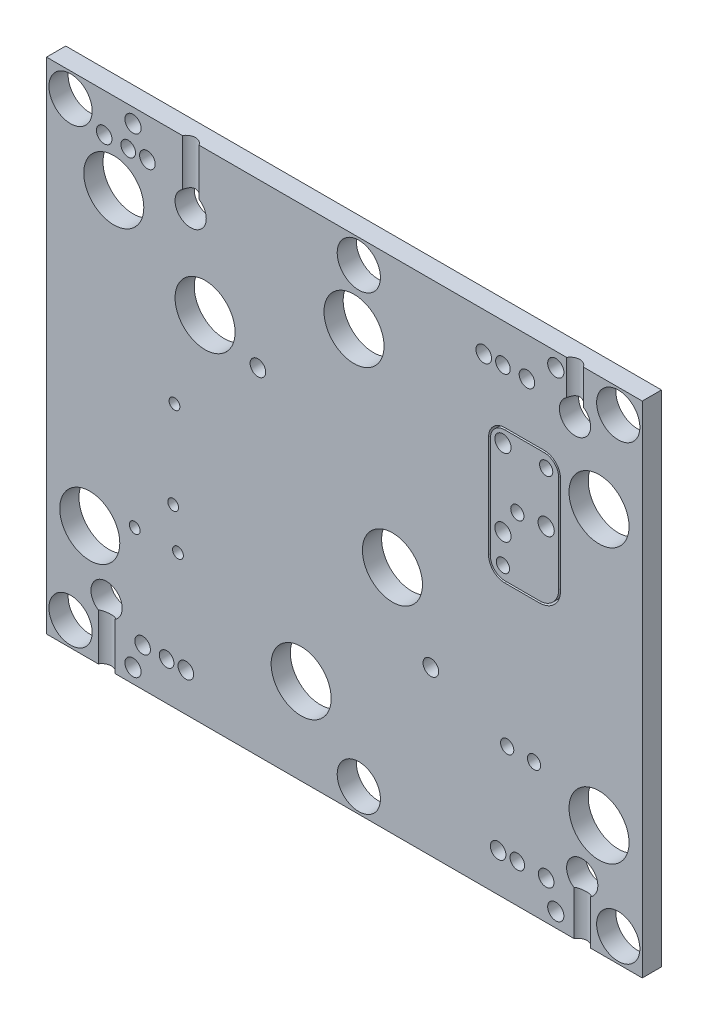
SolidWorks part; units mm, degrees
other "<24051_310_Perf Back-up>-<Hole1>"
ref_plane "Front" through (0, 0, 0) normal (0, 0, 1) x (1, 0, 0)
ref_plane "Top" through (0, 0, 0) normal (0, 1, 0) x (1, 0, 0)
ref_plane "Right" through (0, 0, 0) normal (1, 0, 0) x (0, 0, -1)
sketch "Sketch1" plane through (0, 0, 0) normal (0, 0, 1) x (1, 0, 0)
  line L4 (-57.15, 149.225) -> (-450.85, 149.225)
  line L5 (-450.85, 149.225) -> (-450.85, -180.975)
  line L6 (-450.85, -180.975) -> (-57.15, -180.975)
  line L7 (-57.15, -180.975) -> (-57.15, 149.225)
  line L8 (-57.15, 149.225) -> (-450.85, 149.225)
  line L9 (-450.85, 149.225) -> (-450.85, -180.975)
  line L10 (-450.85, -180.975) -> (-57.15, -180.975)
  line L11 (-57.15, -180.975) -> (-57.15, 149.225)
  dimension "D1" = 0
extrude "Boss-Extrude1" add sketch "Sketch1" along normal blind 12.7 separate body
hole_wizard "Hole1" positions "Point_Sketch" profile "Profil_Sketch" hole size "Ø0.15" standard "ISO"
sketch "Point_Sketch" plane through (-122.7107, 32.8261, 0) normal (0, 0, 1) x (-1, 0, 0)
  point P0 (7.4643, 18.8561)
  point P2 (11.2743, -43.0691)
  point P5 (11.2743, -43.0691)
sketch "Profil_Sketch" plane through (-130.175, 13.97, 0) normal (1, 0, 0) x (0, 1, 0)
  line L0 (0, 0) -> (0, 12.7)
  line L1 (0, 12.7) -> (0.0005, 12.7)
  line L2 (0.0005, 12.7) -> (0.0005, 0)
  line L5 (0.0005, 0) -> (0, 0)
  line L11 (0, -6.35) -> (0, 107.95) construction
  dimension "Diameter" = 0.001
  dimension "Thru Hole Depth" = 12.7
other "usin_Temp_Suppressed<1>"
sketch "Sketch6-P250520R_310_Perf Back-up-1" plane through (0, 0, 0) normal (0, 0, -1) x (-1, 0, 0)
  line L0 (147.955, 87.3252) -> (121.92, 87.3252)
  line L1 (112.395, 77.8002) -> (112.395, 13.6652)
  line L2 (125.095, 0.9652) -> (147.955, 0.9652)
  line L3 (157.48, 10.4902) -> (157.48, 77.8002)
  line L4 (157.48, 10.4902) -> (157.48, 77.8002)
  line L5 (125.095, 0.9652) -> (147.955, 0.9652)
  line L6 (112.395, 77.8002) -> (112.395, 13.6652)
  line L7 (147.955, 87.3252) -> (121.92, 87.3252)
  arc A0 (121.92, 87.3252) -> (112.395, 77.8002) centre (121.92, 77.8002) ccw
  arc A1 (112.395, 13.6652) -> (125.095, 0.9652) centre (125.095, 13.6652) ccw
  arc A2 (147.955, 0.9652) -> (157.48, 10.4902) centre (147.955, 10.4902) ccw
  arc A3 (157.48, 77.8002) -> (147.955, 87.3252) centre (147.955, 77.8002) ccw
  arc A4 (157.48, 77.8002) -> (147.955, 87.3252) centre (147.955, 77.8002) ccw
  arc A5 (147.955, 0.9652) -> (157.48, 10.4902) centre (147.955, 10.4902) ccw
  arc A6 (112.395, 13.6652) -> (125.095, 0.9652) centre (125.095, 13.6652) ccw
  arc A7 (121.92, 87.3252) -> (112.395, 77.8002) centre (121.92, 77.8002) ccw
  circle A9 centre (149.225, 28.2702) radius 3.5687
  arc A10 (128.1938, 79.0702) -> (128.1938, 79.0702) centre (123.825, 79.0702) ccw
  circle A11 centre (142.875, 44.1452) radius 4.3688
  circle A12 centre (149.225, 9.2202) radius 4.3688
  circle A15 centre (120.65, 45.7327) radius 3.5687
  circle A16 centre (149.225, 28.2702) radius 3.5687
  circle A21 centre (120.65, 45.7327) radius 3.5687
  circle A24 centre (149.225, 28.2702) radius 3.5687
sketch "Sketch7-P250520R_310_Perf Back-up-1" plane through (0, 0, 0) normal (0, 0, -1) x (-1, 0, 0)
  line L4 (147.955, 88.5952) -> (121.92, 88.5952)
  line L5 (111.125, 77.8002) -> (111.125, 13.6652)
  line L6 (125.095, -0.3048) -> (147.955, -0.3048)
  line L7 (158.75, 10.4902) -> (158.75, 77.8002)
  line L8 (147.955, 88.5952) -> (121.92, 88.5952)
  line L9 (111.125, 77.8002) -> (111.125, 13.6652)
  line L10 (125.095, -0.3048) -> (147.955, -0.3048)
  line L11 (158.75, 10.4902) -> (158.75, 77.8002)
  arc A4 (121.92, 88.5952) -> (111.125, 77.8002) centre (121.92, 77.8002) ccw
  arc A5 (111.125, 13.6652) -> (125.095, -0.3048) centre (125.095, 13.6652) ccw
  arc A6 (147.955, -0.3048) -> (158.75, 10.4902) centre (147.955, 10.4902) ccw
  arc A7 (158.75, 77.8002) -> (147.955, 88.5952) centre (147.955, 77.8002) ccw
  arc A8 (121.92, 88.5952) -> (111.125, 77.8002) centre (121.92, 77.8002) ccw
  arc A9 (111.125, 13.6652) -> (125.095, -0.3048) centre (125.095, 13.6652) ccw
  arc A10 (147.955, -0.3048) -> (158.75, 10.4902) centre (147.955, 10.4902) ccw
  arc A11 (158.75, 77.8002) -> (147.955, 88.5952) centre (147.955, 77.8002) ccw
extrude "Cut-Extrude9" cut sketch "Sketch7-P250520R_310_Perf Back-up-1" against normal through all
hole_wizard "Hole14" positions "Point_Sketch4" profile "Profil_Sketch4" hole size "Ø0.15" standard "ISO"
sketch "Point_Sketch4" plane through (-43.9707, -113.2239, 0) normal (0, 0, 1) x (-1, 0, 0)
  point P0 (95.7293, 42.3511)
  point P2 (352.9043, -237.0489)
  point P4 (327.5043, 42.3511)
  point P6 (105.2543, -237.0489)
sketch "Profil_Sketch4" plane through (-139.7, -155.575, 0) normal (1, 0, 0) x (0, 1, 0)
  line L0 (0, 0) -> (0, 12.7)
  line L1 (0, 12.7) -> (4.826, 12.7)
  line L2 (4.826, 12.7) -> (4.826, 0)
  line L5 (4.826, 0) -> (0, 0)
  line L11 (0, -6.35) -> (0, 107.95) construction
  dimension "Diameter" = 9.652
  dimension "Thru Hole Depth" = 12.7
other "usin_DL090_.375 x 2.00 DOWEL PIN<4>"
hole_wizard "Hole15" positions "Point_Sketch5" profile "Profil_Sketch5" hole size "Ø0.15" standard "ISO"
sketch "Point_Sketch5" plane through (-364.6457, -113.2239, 0) normal (0, 0, 1) x (-1, 0, 0)
  point P0 (22.7043, 42.3511)
  point P2 (48.1043, -237.0489)
  point P4 (-231.2957, -237.0489)
  point P6 (-243.9957, 42.3511)
  point P8 (-53.4957, -154.4989)
  point P10 (-167.7957, -40.1989)
sketch "Profil_Sketch5" plane through (-387.35, -155.575, 0) normal (1, 0, 0) x (0, 1, 0)
  line L0 (0, 0) -> (0, 12.7)
  line L1 (0, 12.7) -> (5.1562, 12.7)
  line L2 (5.1562, 12.7) -> (5.1562, 0)
  line L5 (5.1562, 0) -> (0, 0)
  line L11 (0, -6.35) -> (0, 107.95) construction
  dimension "Diameter" = 10.3124
  dimension "Thru Hole Depth" = 12.7
other "usin_DL090_.375-16x2-SHCS<5>"
hole_wizard "Hole16" positions "Point_Sketch6" profile "Profil_Sketch6" hole size "Ø0.15" standard "ISO"
sketch "Point_Sketch6" plane through (-78.8957, -110.0489, 0) normal (0, 0, 1) x (-1, 0, 0)
  point P0 (-5.8707, 55.0511)
  point P2 (-5.8707, -243.3989)
  point P4 (356.0793, -243.3989)
  point P6 (356.0793, 55.0511)
  point P8 (165.5793, 55.0511)
  point P10 (165.5793, -243.3989)
sketch "Profil_Sketch6" plane through (-73.025, -165.1, 0) normal (1, 0, 0) x (0, 1, 0)
  line L0 (0, 0) -> (0, 12.7)
  line L1 (0, 12.7) -> (14.2875, 12.7)
  line L2 (14.2875, 12.7) -> (14.2875, 0)
  line L5 (14.2875, 0) -> (0, 0)
  line L11 (0, -6.35) -> (0, 107.95) construction
  dimension "Diameter" = 28.575
  dimension "Thru Hole Depth" = 12.7
other "usin_DL090<6>"
hole_wizard "Hole17" positions "Point_Sketch7" profile "Profil_Sketch7" hole size "Ø0.15" standard "ISO"
sketch "Point_Sketch7" plane through (-51.2793, -68.7739, 12.7) normal (0, 0, -1) x (1, 0, 0)
  point P0 (-34.4457, 39.1761)
  point P2 (-34.4457, -141.7989)
  point P4 (-355.1207, -164.0239)
  point P6 (-370.9957, 36.0011)
  point P8 (-231.2957, 55.0511)
  point P10 (-196.3707, -164.0239)
  point P12 (-294.7957, -122.7489)
  point P14 (-170.9707, -40.1989)
sketch "Profil_Sketch7" plane through (-85.725, -107.95, 12.7) normal (1, 0, 0) x (0, -1, 0)
  line L0 (0, 0) -> (0, 12.7)
  line L1 (0, 12.7) -> (19.8437, 12.7)
  line L2 (19.8437, 12.7) -> (19.8437, 0)
  line L5 (19.8437, 0) -> (0, 0)
  line L11 (0, -6.35) -> (0, 107.95) construction
  dimension "Diameter" = 39.6875
  dimension "Thru Hole Depth" = 12.7
other "usin_DL090_DADCO INCH U 0600.025 - 1500 psi<7>"
hole_wizard "Hole18" positions "Point_Sketch8" profile "Profil_Sketch8" hole size "Ø0.15" standard "ISO"
sketch "Point_Sketch8" plane through (-143.4117, -85.0299, 0) normal (0, 0, 1) x (-1, 0, 0)
  point P0 (3.0193, 8.0611)
  point P2 (-14.7607, 8.0611)
sketch "Profil_Sketch8" plane through (-146.431, -93.091, 0) normal (1, 0, 0) x (0, 1, 0)
  line L0 (0, 0) -> (0, 12.7)
  line L1 (0, 12.7) -> (4.3688, 12.7)
  line L2 (4.3688, 12.7) -> (4.3688, 0)
  line L5 (4.3688, 0) -> (0, 0)
  line L11 (0, -6.35) -> (0, 107.95) construction
  dimension "Diameter" = 8.7376
  dimension "Thru Hole Depth" = 12.7
other "usin_DL090_.3125-18x3.25-SHCS<8>"
hole_wizard "Hole19" positions "Point_Sketch9" profile "Profil_Sketch9" hole size "Ø0.15" standard "ISO"
sketch "Point_Sketch9" plane through (-363.5027, -54.4864, 0) normal (0, 0, 1) x (-1, 0, 0)
  point P0 (3.6543, 10.6011)
  point P2 (29.0543, 36.4456)
  point P4 (0.4793, 36.4456)
sketch "Profil_Sketch9" plane through (-367.157, -65.0875, 0) normal (1, 0, 0) x (0, 1, 0)
  line L0 (0, 0) -> (0, 12.7)
  line L1 (0, 12.7) -> (3.5687, 12.7)
  line L2 (3.5687, 12.7) -> (3.5687, 0)
  line L5 (3.5687, 0) -> (0, 0)
  line L11 (0, -6.35) -> (0, 107.95) construction
  dimension "Diameter" = 7.1374
  dimension "Thru Hole Depth" = 12.7
other "usin_DL090_.25-20x3-SHCS<9>"
hole_wizard "Hole110" positions "Point_Sketch10" profile "Profil_Sketch10" hole size "Ø0.15" standard "ISO"
sketch "Point_Sketch10" plane through (-362.6341, 3.6553, 0) normal (0, 0, 1) x (-1, 0, 0)
  point P0 (3.6543, 10.6011)
sketch "Profil_Sketch10" plane through (-366.2883, -6.9458, 0) normal (1, 0, 0) x (0, 1, 0)
  line L0 (0, 0) -> (0, 12.7)
  line L1 (0, 12.7) -> (3.5687, 12.7)
  line L2 (3.5687, 12.7) -> (3.5687, 0)
  line L5 (3.5687, 0) -> (0, 0)
  line L11 (0, -6.35) -> (0, 107.95) construction
  dimension "Diameter" = 7.1374
  dimension "Thru Hole Depth" = 12.7
other "usin_DL090_.25-20x1.5-SHCS<10>"
hole_wizard "Hole111" positions "Point_Sketch11" profile "Profil_Sketch11" counterbore size "1/4" standard "ANSI Inch"
sketch "Point_Sketch11" plane through (-425.6191, 140.635, 12.7) normal (0, 0, -1) x (1, 0, 0)
  point P0 (31.9191, 0.935)
  point P2 (31.9191, 312.085)
  point P4 (311.3191, 312.085)
  point P6 (311.3191, 0.935)
sketch "Profil_Sketch11" plane through (-393.7, 139.7, 12.7) normal (1, 0, 0) x (0, -1, 0)
  line L0 (0, 0) -> (0, 12.7)
  line L1 (0, 12.7) -> (3.5687, 12.7)
  line L3 (3.5687, 12.7) -> (3.5687, 7.874)
  line L4 (3.5687, 7.874) -> (5.3594, 7.874)
  line L5 (5.3594, 7.874) -> (5.3594, 0)
  line L7 (5.3594, 0) -> (0, 0)
  line L11 (0, -6.35) -> (0, 107.95) construction
  dimension "Diameter" = 7.1374
  dimension "Thru Hole Depth" = 12.7
  dimension "L1" = 7.874
other "usin_LS160_.25-20x.625-SHCS<1>"
hole_wizard "Hole112" positions "Point_Sketch12" profile "Profil_Sketch12" hole size "Ø0.15" standard "ISO"
sketch "Point_Sketch12" plane through (-97.9457, 128.0761, 0) normal (0, 0, 1) x (-1, 0, 0)
  point P0 (3.6543, 10.6011)
  point P2 (-1.1082, 270.9511)
  point P4 (313.2168, 269.3636)
  point P6 (257.6543, 18.5386)
sketch "Profil_Sketch12" plane through (-101.6, 117.475, 0) normal (1, 0, 0) x (0, 1, 0)
  line L0 (0, 0) -> (0, 12.7)
  line L1 (0, 12.7) -> (10.3187, 12.7)
  line L2 (10.3187, 12.7) -> (10.3187, 0)
  line L5 (10.3187, 0) -> (0, 0)
  line L11 (0, -6.35) -> (0, 107.95) construction
  dimension "Diameter" = 20.6375
  dimension "Thru Hole Depth" = 12.7
other "usin_DL090<11>"
hole_wizard "Hole113" positions "Point_Sketch13" profile "Profil_Sketch13" hole size "Ø0.15" standard "ISO"
sketch "Point_Sketch13" plane through (-380.5207, 134.4261, 0) normal (0, 0, 1) x (-1, 0, 0)
  point P0 (3.6543, 10.6011)
  point P2 (-21.7457, 290.0011)
  point P4 (-228.1207, 290.0011)
  point P6 (-218.5957, 10.6011)
sketch "Profil_Sketch13" plane through (-384.175, 123.825, 0) normal (1, 0, 0) x (0, 1, 0)
  line L0 (0, 0) -> (0, 12.7)
  line L1 (0, 12.7) -> (5.1594, 12.7)
  line L2 (5.1594, 12.7) -> (5.1594, 0)
  line L5 (5.1594, 0) -> (0, 0)
  line L11 (0, -6.35) -> (0, 107.95) construction
  dimension "Diameter" = 10.3187
  dimension "Thru Hole Depth" = 12.7
other "usin_DL090<12>"
sketch "Sketch5" plane through (0, -180.975, 0) normal (0, -1, 0) x (1, 0, 0)
  line L0 (-450.85, 12.7) -> (-57.15, 12.7) construction
  line L1 (-411.1625, 12.7) -> (-411.1625, 0) construction
  line L2 (-96.8375, 12.7) -> (-96.8375, 0) construction
  circle A0 centre (-411.1625, 15.875) radius 6.35
  circle A1 centre (-96.8375, 15.875) radius 6.35
  dimension "D1" = 3.175
  dimension "D2" = 12.7
extrude "Cut-Extrude10" cut sketch "Sketch5" against normal up to next
sketch "Sketch6" plane through (0, 149.225, 0) normal (0, 1, 0) x (1, 0, 0)
  line L0 (-57.15, -12.7) -> (-450.85, -12.7) construction
  line L1 (-101.6, -12.7) -> (-101.6, 0) construction
  line L2 (-355.6, -12.7) -> (-355.6, 0) construction
  circle A0 centre (-101.6, -15.875) radius 6.35
  circle A1 centre (-355.6, -15.875) radius 6.35
  dimension "D2" = 12.7
  dimension "D1" = 3.175
extrude "Cut-Extrude11" cut sketch "Sketch6" against normal up to next
sketch "Sketch1 _Machining axis" plane through (0, 0, 12.7) normal (0, 0, 1) x (1, 0, 0)
  line L0 (-138.1125, 4.7752) -> (-138.1125, -0.3048) construction
  line L1 (-125.095, -0.3048) -> (-147.955, -0.3048) construction
  point P0 (-138.1125, 4.7752)
sketch "Sketch1 _Wire EDM" plane through (0, 0, 12.7) normal (0, 0, 1) x (1, 0, 0)
  circle A0 centre (-138.1125, 4.7752) radius 1.5875
inserted part "24051_310_Perf Back-up1" parameters "D1"=0, "D2"=0, "D3"=71.9582
move or copy body "Body-Move/Copy2"
